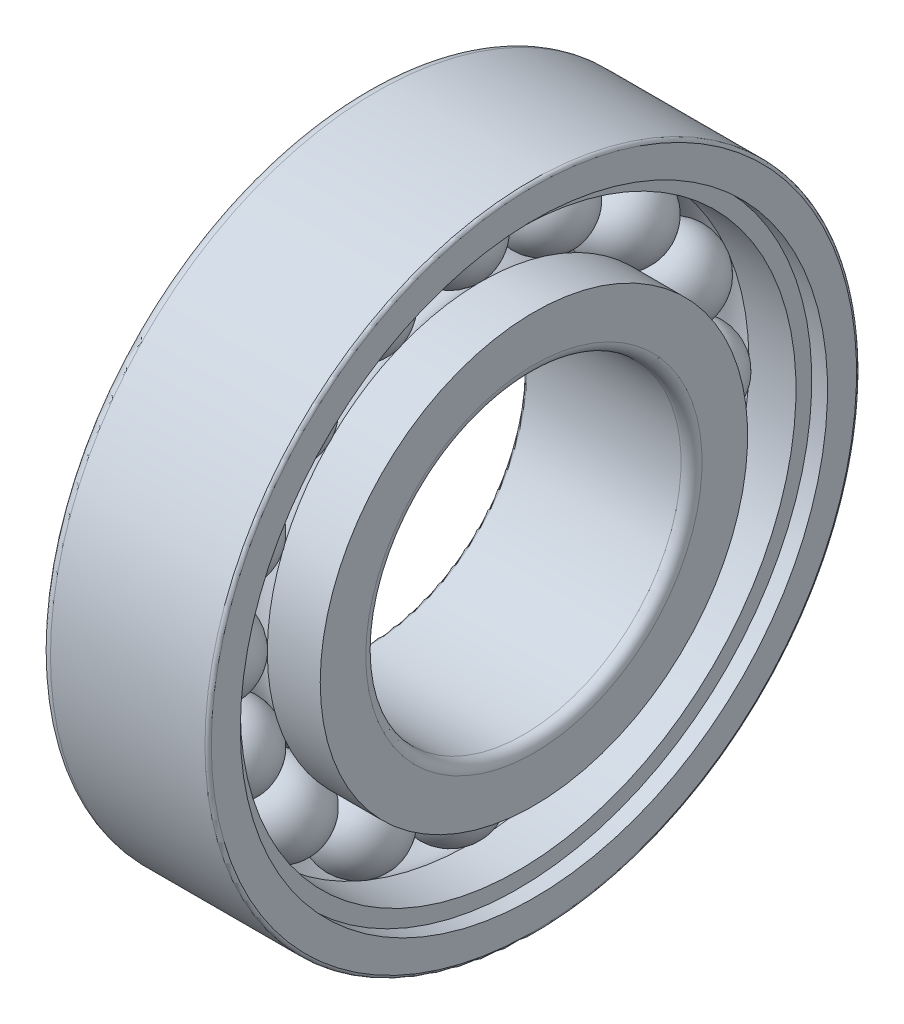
SolidWorks part; units mm, degrees
ref_plane "Front" through (0, 0, 0) normal (0, 0, 1) x (1, 0, 0)
ref_plane "Top" through (0, 0, 0) normal (0, 1, 0) x (1, 0, 0)
ref_plane "Right" through (0, 0, 0) normal (1, 0, 0) x (0, 0, -1)
sketch "Sketch1" plane through (0, 0, 0) normal (0, 0, 1) x (1, 0, 0)
  line L0 (-3.0919, 0) -> (2.899, 0) construction
  line L1 (-3.0919, 23) -> (2.899, 23) construction
  line L2 (-4, 23) -> (4, 23)
  arc A0 (-4, 23) -> (4, 23) centre (0, 23) ccw
revolve "Revolve1" add sketch "Sketch1" angle 360 about L1
sketch "Sketch2" plane through (0, 0, 0) normal (0, 0, 1) x (1, 0, 0)
  line L0 (-8, 20.3333) -> (-2.968, 20.3333)
  line L1 (8, 20.3333) -> (8, 15)
  line L2 (8, 15) -> (-8, 15)
  line L3 (-8, 15) -> (-8, 20.3333)
  line L4 (-2.9924, 0) -> (3.9982, 0) construction
  line L5 (-1.8743, 23) -> (3.1755, 23) construction
  line L7 (2.968, 20.3333) -> (8, 20.3333)
  line L8 (-8, 6.2861) -> (-8, 1.454) construction
  arc A0 (-2.968, 20.3333) -> (2.968, 20.3333) centre (0, 23) ccw
revolve "Revolve2" add sketch "Sketch2" angle 360 about L4
sketch "Sketch3" plane through (0, 0, 0) normal (0, 0, 1) x (1, 0, 0)
  line L0 (-8, 25.6667) -> (-8, 31)
  line L1 (-8, 31) -> (8, 31)
  line L2 (8, 31) -> (8, 27.9367)
  line L3 (6.5, 26.4367) -> (2.0272, 26.4367)
  line L4 (-2.9924, 0) -> (3.4329, 0) construction
  line L6 (-1.7375, 23) -> (2.2712, 23) construction
  line L7 (-2.968, 25.6667) -> (-8, 25.6667)
  line L8 (6.5, 26.4367) -> (6.5, 27.9367)
  line L9 (6.5, 27.9367) -> (8, 27.9367)
  arc A0 (2.0272, 26.4367) -> (-2.968, 25.6667) centre (0, 23) ccw
revolve "Revolve3" add sketch "Sketch3" angle 360 about L4
pattern_circular "Circular-Pattern1" count 16 over 360 about axis through (0, 0, 0) along (1, 0, 0) of "Revolve1"
fillet "Fillet1" radius 1 2 edges at (8, 0, 15) (-8, 0, 31)
fillet "Fillet2" radius 0.3 2 edges at (8, 0, 31) (-8, 0, 15)
equation "\"R@Sketch1\" =  ( \"DD@Sketch3\" - \"d@Sketch2\" )  / 8"
equation "\"D1@Sketch1\"=(\"d@Sketch2\"+\"DD@Sketch3\")/4"
equation "\"D1@Sketch2\"=(\"d@Sketch2\"+\"DD@Sketch3\")/4"
equation "\"D3@Sketch2\" =  \"d@Sketch2\"+  ( \"DD@Sketch3\" - \"d@Sketch2\" )  /3"
equation "\"D2@Sketch2\" =  ( \"DD@Sketch3\" - \"d@Sketch2\" )  / 8 - 0.01"
equation "\"D6@Sketch2\" = \"B@Sketch2\" / 2"
equation "\"B@Sketch3\" = \"B@Sketch2\""
equation "\"D2@Sketch3\" = \"B@Sketch3\" / 2"
equation "\"D1@Sketch3\"=(\"d@Sketch2\"+\"DD@Sketch3\")/4"
equation "\"D3@Sketch3\" = (  \"DD@Sketch3\" -  (\"DD@Sketch3\" - \"d@Sketch2\"  )  / 3 )  * 1.03"
equation "\"D5@Sketch3\" = \"DD@Sketch3\" -  (  \"DD@Sketch3\" - \"d@Sketch2\")  / 3"
equation "\"D6@Sketch3\" = \"d@Sketch2\" / 20"
equation "\"D7@Sketch3\"=\"D6@Sketch3\""
equation "\"D4@Sketch3\"=(\"DD@Sketch3\"-\"d@Sketch2\")/8-0.01"
equation "\"m@Circular-Pattern1\" = int( 3.14159265 / atn(\"R@Sketch1\" / sqr((\"d@Sketch2\"+\"DD@Sketch3\")/4 * (\"d@Sketch2\"+\"DD@Sketch3\")/4 - \"R@Sketch1\" *  \"R@Sketch1\")))-1"
